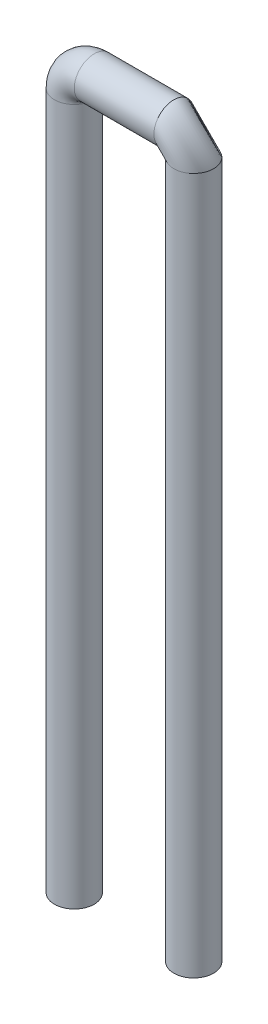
SolidWorks part; units mm, degrees
ref_plane "Plan de face" through (0, 0, 0) normal (0, 0, 1) x (1, 0, 0)
ref_plane "Plan de dessus" through (0, 0, 0) normal (0, 1, 0) x (1, 0, 0)
ref_plane "Plan de droite" through (0, 0, 0) normal (1, 0, 0) x (0, 0, -1)
sketch "Esquisse1" plane through (0, 0, 0) normal (0, 0, 1) x (1, 0, 0)
  line L0 (0, 0) -> (0, 17.5)
  line L1 (0.5, 18) -> (2.5, 18)
  line L2 (3, 17.5) -> (3, 0)
  arc A0 (0.5, 18) -> (0, 17.5) centre (0.5, 17.5) ccw
  arc A1 (2.5, 18) -> (3, 17.5) centre (2.5, 17.5) cw
  point P7 (0, 18)
  dimension "D3" = 0.5
  dimension "D4" = 0.5
  dimension "D1" = 3
  dimension "D2" = 18
sketch "Esquisse2" plane through (0, 0, 0) normal (0, 1, 0) x (1, 0, 0)
  circle A0 centre (0, 0) radius 0.5
  dimension "D1" = 1
sweep "Balayage1" add profiles "Esquisse2" path "Esquisse1"
